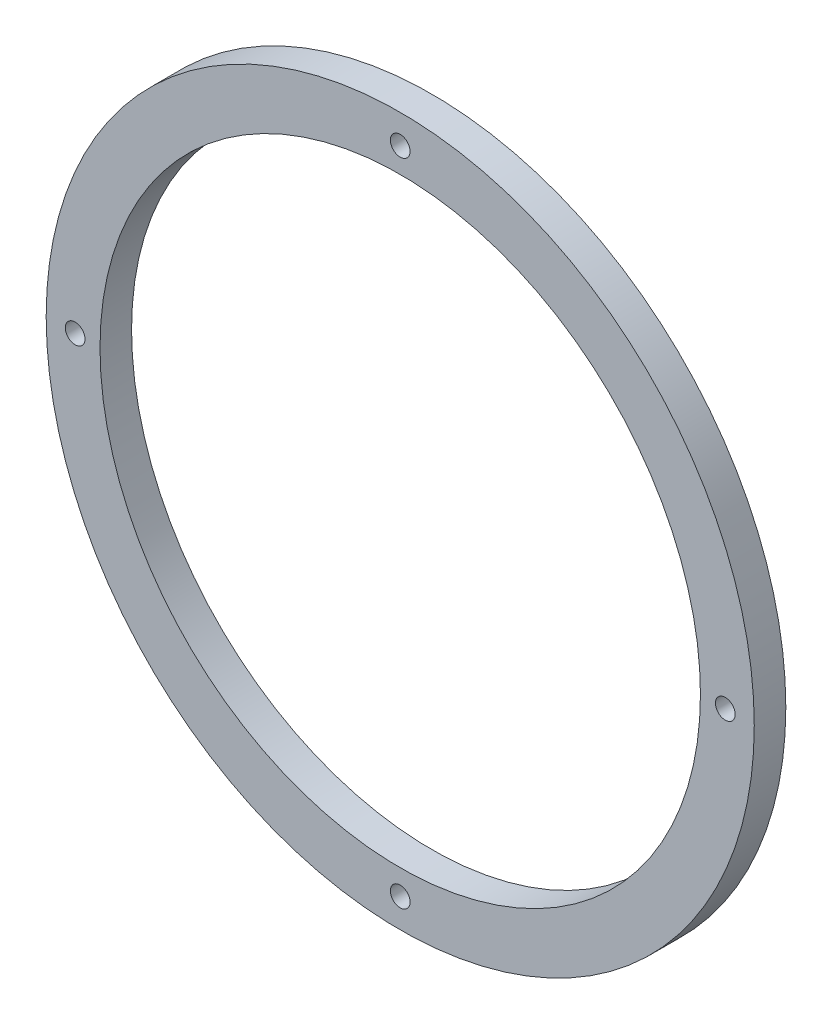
SolidWorks part; units mm, degrees
ref_plane "Front Plane" through (0, 0, 0) normal (0, 0, 1) x (1, 0, 0)
ref_plane "Top Plane" through (0, 0, 0) normal (0, 1, 0) x (1, 0, 0)
ref_plane "Right Plane" through (0, 0, 0) normal (1, 0, 0) x (0, 0, -1)
sketch "Sketch1" plane through (0, 0, 0) normal (0, 0, 1) x (1, 0, 0)
  line L0 (0, 78.5) -> (0, 0) construction
  line L1 (0, 0) -> (-78.5, 0) construction
  circle A0 centre (0, 0) radius 72.5
  circle A1 centre (0, 0) radius 85.5
  circle A2 centre (0, 78.5) radius 2.3812
  circle A3 centre (78.5, 0) radius 2.3813
  circle A4 centre (0, -78.5) radius 2.3812
  circle A5 centre (-78.5, 0) radius 2.3813
  point P16 (0, 0)
  dimension "D1" = 145
  dimension "D4" = 4.7625
  dimension "D3" = 78.5
  dimension "D6" = 78.5
  dimension "D2" = 13
  dimension "D5" = 4
extrude "Boss-Extrude1" add sketch "Sketch1" along normal blind 7.62
